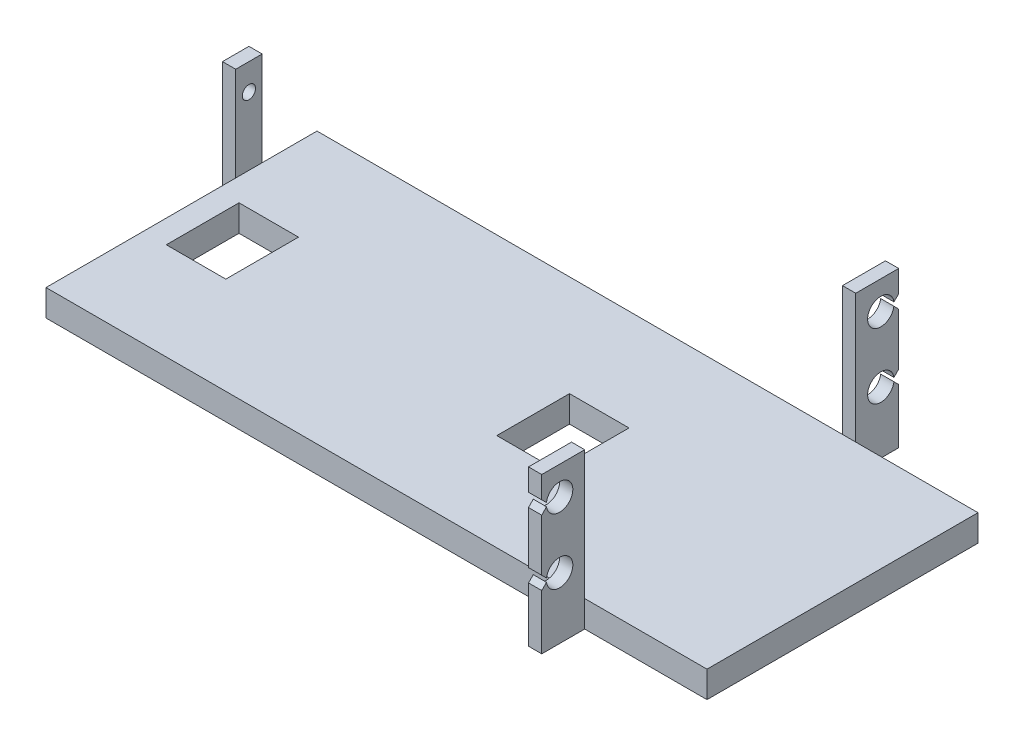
SolidWorks part; units mm, degrees
ref_plane "Front Plane" through (0, 0, 0) normal (0, 0, 1) x (1, 0, 0)
ref_plane "Top Plane" through (0, 0, 0) normal (0, 1, 0) x (1, 0, 0)
ref_plane "Right Plane" through (0, 0, 0) normal (1, 0, 0) x (0, 0, -1)
sketch "Sketch1" plane through (0, 0, 0) normal (0, 1, 0) x (1, 0, 0)
  line L1 (0, 0) -> (100, 0)
  line L2 (0, 0) -> (0, -41)
  line L3 (0, -41) -> (100, -41)
  line L4 (100, 0) -> (100, -41)
  dimension "D1" = 100
  dimension "D2" = 41
extrude "Boss-Extrude1" add sketch "Sketch1" along normal blind 4
sketch "Sketch2" plane through (0, 0, 0) normal (0, 1, 0) x (1, 0, 0)
  line L0 (8, -15.3) -> (8, -26.3) construction
  line L1 (3.5, -15.3) -> (12.5, -15.3)
  line L2 (3.5, -15.3) -> (3.5, -26.3)
  line L3 (3.5, -26.3) -> (12.5, -26.3)
  line L4 (12.5, -15.3) -> (12.5, -26.3)
  line L5 (53.5, -15.3) -> (62.5, -15.3)
  line L6 (53.5, -15.3) -> (53.5, -26.3)
  line L7 (53.5, -26.3) -> (62.5, -26.3)
  line L8 (62.5, -15.3) -> (62.5, -26.3)
  line L9 (58, -15.3) -> (58, -26.3) construction
  line L10 (100, -41) -> (100, 0) construction
  line L12 (100, 0) -> (0, 0) construction
  point P12 (8, -20.8)
  point P13 (58, -20.8)
  dimension "D1" = 50
  dimension "D2" = 42
  dimension "D3" = 9
  dimension "D4" = 11
  dimension "D5" = 15.3
extrude "Cut-Extrude2" cut sketch "Sketch2" along normal through all
ref_plane "Plane1" through (0, 4, 0) normal (0, 1, 0) x (1, 0, 0)
ref_plane "Plane2" through (0, 0, 41) normal (0, 0, 1) x (1, 0, 0)
sketch "Sketch5" plane through (0, 0, 41) normal (0, 0, 1) x (1, 0, 0)
  line L0 (22.55, 4) -> (-22.55, 4) construction
  line L1 (81.5, 4) -> (79.5, 4)
  line L2 (81.5, 4) -> (81.5, 0)
  line L3 (81.5, 0) -> (79.5, 0)
  line L4 (79.5, 4) -> (79.5, 0)
  line L5 (0, 0) -> (100, 0) construction
  line L9 (100, 4) -> (100, 0) construction
  dimension "D1" = 2
  dimension "D2" = 18.5
extrude "Boss-Extrude2" add sketch "Sketch5" along normal blind 6.5
sketch "Sketch6" plane through (0, 4, 0) normal (0, 1, 0) x (1, 0, 0)
  line L0 (-2.2, -41) -> (2.2, -41) construction
  line L1 (79.5, -47.5) -> (81.5, -47.5)
  line L2 (79.5, -47.5) -> (79.5, -41)
  line L3 (79.5, -41) -> (81.5, -41)
  line L4 (81.5, -47.5) -> (81.5, -41)
  line L5 (81.5, -47.5) -> (81.5, -41) construction
extrude "Boss-Extrude3" add sketch "Sketch6" along normal blind 19.5
ref_plane "Plane3" through (81.5, 0, 0) normal (1, 0, 0) x (0, 0, -1)
sketch "Sketch7" plane through (81.5, 0, 0) normal (1, 0, 0) x (0, 0, -1)
  line L0 (-47.5, 0) -> (-47.5, 23.5) construction
  line L1 (-47.5, 23.5) -> (-41, 23.5) construction
  line L2 (-47.5, 10.3) -> (-46.5, 9.3)
  line L7 (-46.5, 9.3) -> (-47.5, 8.3)
  line L8 (-47.5, 20.1749) -> (-46.5003, 19.2)
  line L9 (-46.5003, 19.2) -> (-47.5, 18.1749)
  line L10 (-47.5, 20.1749) -> (-47.5, 18.1749)
  line L11 (-47.5, 10.3) -> (-47.5, 8.3)
  circle A0 centre (-44.8, 19.2) radius 2
  circle A1 centre (-44.8, 9.3) radius 2
  dimension "D1" = 4
  dimension "D2" = 2.7
  dimension "D3" = 4.3
  dimension "D4" = 14.2
  dimension "D5" = 2
  dimension "D7" = 46.5003
extrude "Cut-Extrude3" cut sketch "Sketch7" against normal blind 19.5 contours L9 A0 L8 | L7 A1 L2 | A1 L2 L11 L7 | L2 A1 L7
ref_plane "Plane4" through (0, 0, 20.5) normal (0, 0, -1) x (-1, 0, 0)
mirror "Mirror1" about plane through (0, 0, 20.5) normal (0, 0, -1) of "Cut-Extrude3", "Boss-Extrude3", "Boss-Extrude2"
ref_plane "Plane5" through (53.5, 0, 0) normal (1, 0, 0) x (0, 0, -1)
sketch "Sketch9" plane through (53.5, 0, 0) normal (1, 0, 0) x (0, 0, -1)
  line L0 (-41, 23.5) -> (-41, -49976.5) construction
  line L1 (-28.3078, 2.6667) -> (49971.6922, 2.6667) construction
  line L2 (-37, 1.2958) -> (-36.6306, 0)
  line L3 (-37, 9.0411) -> (-37, -49990.9589) construction
  line L4 (-37, 1.2958) -> (-32.1916, 2.6667)
  line L5 (-41, 0) -> (0, 0) construction
  line L6 (-32.1916, 2.6667) -> (-31.4313, 0)
  line L7 (22.55, 4) -> (-22.55, 4) construction
  line L9 (-36.6306, 0) -> (-31.4313, 0)
  point P12 (0, 0)
  dimension "D1" = 4
  dimension "D2" = 1.3333
  dimension "D3" = 74.087
  dimension "D4" = 5
extrude "Cut-Extrude4" cut sketch "Sketch9" along normal up to surface (9 mm away)
sketch "Sketch14" plane through (3.5, 0, 0) normal (1, 0, 0) x (0, 0, -1)
  line L0 (-41, 23.5) -> (-41, -49976.5) construction
  line L1 (-28.3078, 2.6667) -> (49971.6922, 2.6667) construction
  line L2 (-37, 1.2958) -> (-36.6306, 0)
  line L3 (-37, 9.0411) -> (-37, -49990.9589) construction
  line L4 (-37, 1.2958) -> (-32.1916, 2.6667)
  line L5 (-41, 4) -> (-41, 0) construction
  line L6 (-32.1916, 2.6667) -> (-31.4313, 0)
  line L7 (-15.3, 0) -> (-26.3, 0) construction
  line L9 (-36.6306, 0) -> (-31.4313, 0)
  point P12 (0, 0)
extrude "Cut-Extrude7" cut sketch "Sketch14" along normal up to surface (9 mm away)
ref_plane "Plane6" through (0, 0, 0) normal (-1, 0, 0) x (0, 0, 1)
sketch "Sketch11" plane through (0, 0, 0) normal (-1, 0, 0) x (0, 0, 1)
  line L0 (0, 4) -> (41, 4) construction
  line L1 (8.3, 4) -> (12.3, 4)
  line L2 (8.3, 4) -> (8.3, 0)
  line L3 (8.3, 0) -> (12.3, 0)
  line L4 (12.3, 4) -> (12.3, 0)
  line L5 (0, 0) -> (41, 0) construction
  line L6 (0, 4) -> (0, 0) construction
  dimension "D1" = 4
  dimension "D2" = 8.3
extrude "Boss-Extrude4" add sketch "Sketch11" along normal blind 2
sketch "Sketch12" plane through (0, 4, 0) normal (0, 1, 0) x (1, 0, 0)
  line L1 (-2, -8.3) -> (0, -8.3)
  line L2 (-2, -8.3) -> (-2, -12.3)
  line L3 (-2, -12.3) -> (0, -12.3)
  line L4 (0, -8.3) -> (0, -12.3)
extrude "Boss-Extrude5" add sketch "Sketch12" along normal blind 14.25
ref_plane "Plane7" through (-2, 0, 0) normal (-1, 0, 0) x (0, 0, 1)
sketch "Sketch13" plane through (-2, 0, 0) normal (-1, 0, 0) x (0, 0, 1)
  line L0 (8.3, 18.25) -> (12.3, 18.25) construction
  circle A0 centre (10.3, 14.25) radius 1
  point P2 (0, 0)
  point P5 (10.3, 18.25)
  dimension "D1" = 2
  dimension "D2" = 4
extrude "Cut-Extrude6" cut sketch "Sketch13" against normal blind 2
